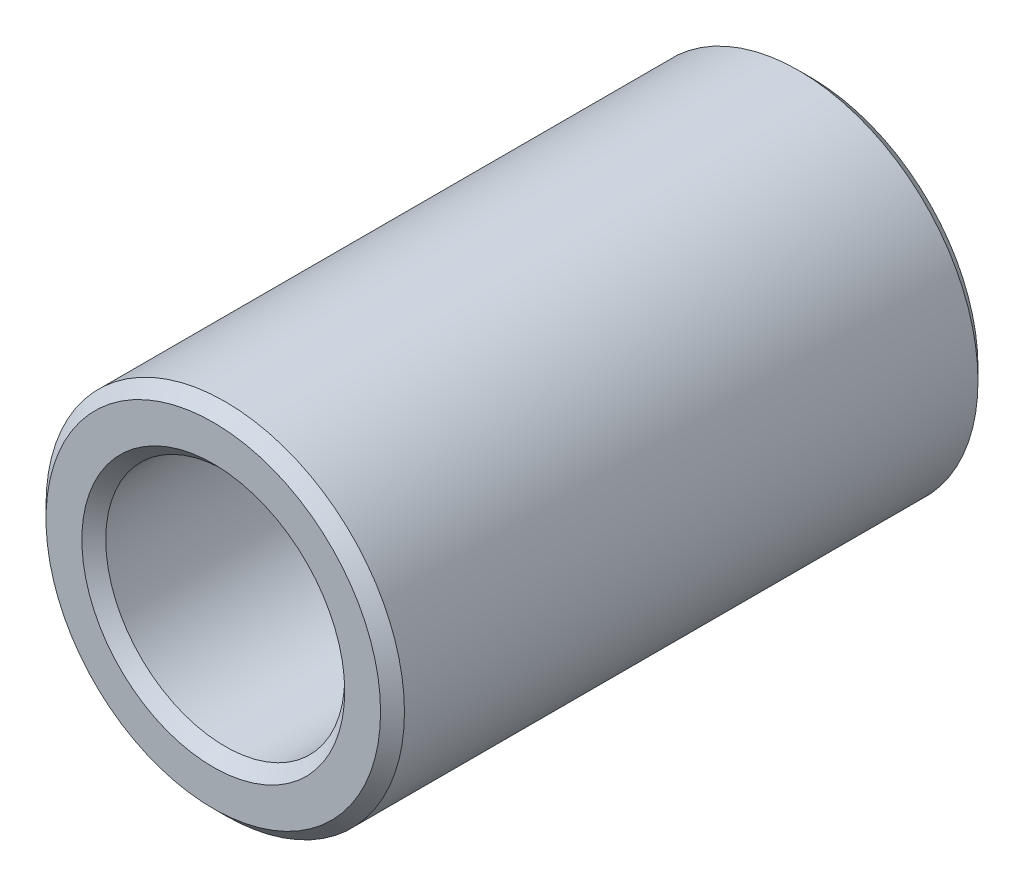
SolidWorks part; units mm, degrees
ref_plane "Face" through (0, 0, 0) normal (0, 0, 1) x (1, 0, 0)
ref_plane "Dessus" through (0, 0, 0) normal (0, 1, 0) x (1, 0, 0)
ref_plane "Côté" through (0, 0, 0) normal (1, 0, 0) x (0, 0, -1)
sketch "Esquisse1" plane through (0, 0, 0) normal (0, 0, 1) x (1, 0, 0)
  circle A0 centre (0, 0) radius 5
  circle A1 centre (0, 0) radius 7.5
  dimension "Ø1" = 10
  dimension "Ø2" = 15
extrude "Base-Extrusion" add sketch "Esquisse1" along normal blind 25
chamfer "Chanfrein1" distance 0.5 angle 45 4 edges at (7.5, 0, 0) (7.5, 0, 25) (5, 0, 0) (5, 0, 25)
